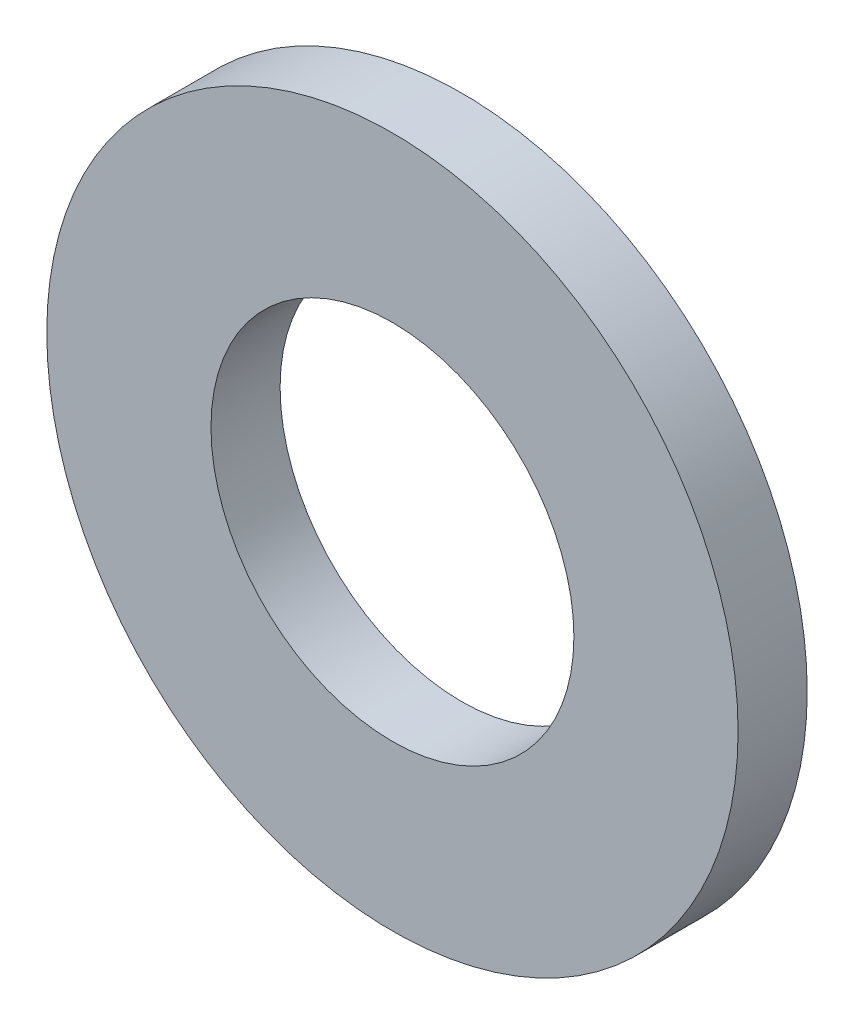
SolidWorks part; units mm, degrees
ref_plane "Plan de face" through (0, 0, 0) normal (0, 0, 1) x (1, 0, 0)
ref_plane "Plan de dessus" through (0, 0, 0) normal (0, 1, 0) x (1, 0, 0)
ref_plane "Plan de droite" through (0, 0, 0) normal (1, 0, 0) x (0, 0, -1)
ref_plane "Plan1" through (0, 0, 0) normal (0, -1, 0) x (1, 0, 0)
sketch "Esquisse1" plane through (0, 0, 0) normal (0, -1, 0) x (1, 0, 0)
  line L0 (8, -1.6) -> (8, 0)
  line L1 (8, 0) -> (4.2, 0)
  line L2 (4.2, 0) -> (4.2, -1.6)
  line L3 (4.2, -1.6) -> (8, -1.6)
  line L4 (0, 0) -> (0, -1.6) construction
revolve "Révolution1" add sketch "Esquisse1" angle 360 about L4
